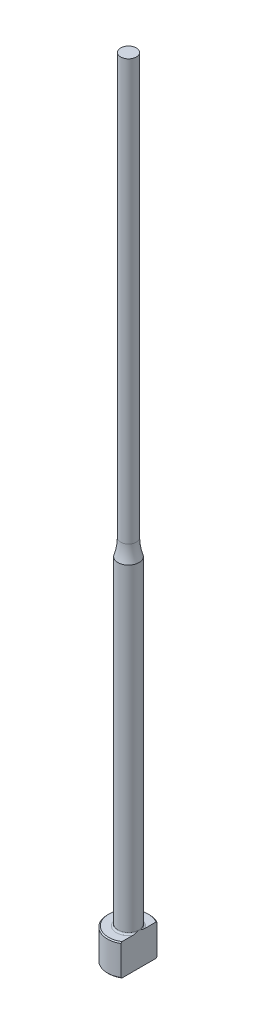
SolidWorks part; units mm, degrees
ref_plane "Front Plane" through (0, 0, 0) normal (0, 0, 1) x (1, 0, 0)
ref_plane "Top Plane" through (0, 0, 0) normal (0, 1, 0) x (1, 0, 0)
ref_plane "Right Plane" through (0, 0, 0) normal (1, 0, 0) x (0, 0, -1)
sketch "Sketch1" plane through (0, 0, 0) normal (0, 0, 1) x (1, 0, 0)
  line L0 (0, 259.9588) -> (0, -15.1925) construction
  line L1 (0, 0) -> (-4, 0)
  line L2 (-4, 0) -> (-4, 6)
  line L3 (-4, 6) -> (-2, 6)
  line L4 (-1.5, 70) -> (-1.5, 150)
  line L5 (-1.5, 150) -> (0, 150)
  line L6 (0, 150) -> (0, 0)
  line L7 (-2, 6) -> (-2, 66.8775)
  arc A0 (-2, 66.8775) -> (-1.5, 70) centre (-11.5, 70) ccw
  point P13 (-2, 0)
  dimension "D1" = 10
  dimension "L" = 150
  dimension "H" = 8
  dimension "T" = 6
  dimension "D" = 3
  dimension "B" = 4
  dimension "S" = 70
revolve "Revolve1" add sketch "Sketch1" angle 360 about L0
chamfer "Chamfer1" distance 0.2 angle 45 2 edges at (0, 6, 4) (0, 0, 4)
fillet "Fillet1" radius 0.3 1 edges at (0, 6, 2)
sketch "Sketch2" plane through (0, 0, 0) normal (0, 1, 0) x (1, 0, 0)
  line L0 (2, -3.4641) -> (2, 3.4641)
  circle A0 centre (0, 0) radius 4 construction
  arc A1 (2, -3.4641) -> (2, 3.4641) centre (0, 0) ccw
  circle A2 centre (0, 0) radius 2 construction
extrude "Keyed Head" cut sketch "Sketch2" along normal through all
